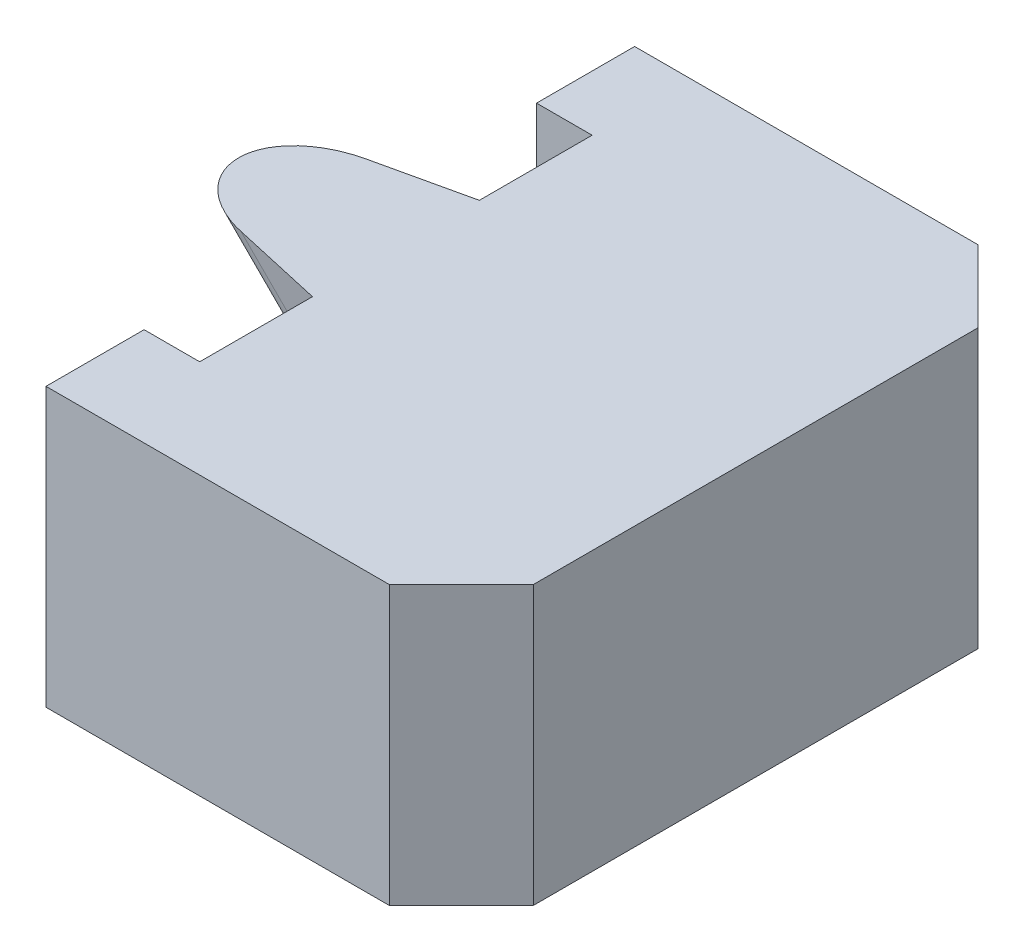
SolidWorks part; units mm, degrees
ref_plane "Vorne" through (0, 0, 0) normal (0, 0, 1) x (1, 0, 0)
ref_plane "Oben" through (0, 0, 0) normal (0, 1, 0) x (1, 0, 0)
ref_plane "Rechts" through (0, 0, 0) normal (1, 0, 0) x (0, 0, -1)
sketch "Skizze1" plane through (0, 0, 0) normal (0, 1, 0) x (1, 0, 0)
  line L1 (-44.6813, 23.83) -> (41.1068, 23.83)
  line L2 (-44.6813, 23.83) -> (-44.6813, -33.362)
  line L3 (-44.6813, -33.362) -> (41.1068, -33.362)
  line L4 (41.1068, 23.83) -> (41.1068, -33.362)
extrude "Linear austragen1" add sketch "Skizze1" along normal blind 12.5
sketch "Skizze2" plane through (0, 0, 0) normal (0, -1, 0) x (1, 0, 0)
  line L0 (-26.3604, 10.766) -> (-21.6604, 10.766)
  line L1 (-26.3604, 13.766) -> (-15.8604, 13.766)
  line L2 (-15.8604, 13.766) -> (-13.6604, 11.566)
  line L3 (-26.3604, -4.234) -> (-15.8604, -4.234)
  line L4 (-13.6604, 11.566) -> (-13.6604, -2.034)
  line L5 (-21.6604, 10.766) -> (-21.6604, -1.234)
  line L6 (-21.6604, -1.234) -> (-26.3604, -1.234)
  line L7 (-13.6604, -2.034) -> (-15.8604, -4.234)
  line L8 (-21.6604, 4.766) -> (-44.6813, 4.766) construction
  line L9 (-44.6813, -23.83) -> (-44.6813, 33.362) construction
  line L10 (-26.3604, -4.234) -> (-26.3604, -1.234)
  line L11 (-26.3604, 13.766) -> (-26.3604, 10.766)
  dimension "D1" = 18
  dimension "D2" = 3
  dimension "D3" = 3
  dimension "D6" = 8
extrude "Linear austragen2" add sketch "Skizze2" along normal blind 8.5
fillet "Verrundung1" radius 3 1 edges at (-21.6604, 0, 4.766)
ref_plane "Ebene1" through (0, 0, 4.766) normal (0, 0, -1) x (-1, 0, 0)
sketch "Skizze3" plane through (0, 0, 4.766) normal (0, 0, -1) x (-1, 0, 0)
  line L0 (19.6604, -6.5) -> (22.6604, -3.5)
  line L1 (26.3604, -8.5) -> (15.8604, -8.5) construction
  line L3 (15.8604, -8.5) -> (26.3604, -8.5) construction
  line L4 (13.6604, -8.5) -> (13.6604, 0) construction
  line L5 (26.3604, -8.5) -> (15.8604, -8.5) construction
  dimension "D1" = 45
  dimension "D2" = 2
  dimension "D3" = 9
  dimension "D4" = 5
ref_plane "Ebene2" through (-19.6604, -6.5, 4.766) normal (-0.7071, 0.7071, 0) x (0, 0, 1)
sketch "Skizze4" plane through (-19.6604, -6.5, 4.766) normal (-0.7071, 0.7071, 0) x (0, 0, 1)
  line L0 (0, -2.8284) -> (0, 4.5067) construction
  line L1 (-1.9154, -0.9378) -> (-3, 2.4716)
  line L2 (1.9154, -0.9378) -> (3, 2.4716)
  line L3 (-3, 2.4716) -> (3, 2.4716)
  line L5 (6, -2.8284) -> (-6, -2.8284) construction
  arc A0 (1.9154, -0.9378) -> (-1.9154, -0.9378) centre (0, -0.3284) cw
  point P8 (0, 2.4716)
  dimension "D4" = 2.01
  dimension "D1" = 6
  dimension "D2" = 5.3
  dimension "D3" = 2.5
extrude "Linear austragen3" add sketch "Skizze4" along normal blind 20
sketch "Skizze5" plane through (0, 0, -23.83) normal (0, 0, -1) x (-1, 0, 0)
  line L4 (-41.1068, 0) -> (44.6813, 0)
  line L5 (44.6813, 0) -> (44.6813, 12.5)
  line L6 (44.6813, 12.5) -> (-41.1068, 12.5)
  line L7 (-41.1068, 12.5) -> (-41.1068, 0)
  line L8 (-41.1068, 0) -> (44.6813, 0)
  line L9 (44.6813, 0) -> (44.6813, 12.5)
  line L10 (44.6813, 12.5) -> (-41.1068, 12.5)
  line L11 (-41.1068, 12.5) -> (-41.1068, 0)
  dimension "D1" = 0
extrude "Schnitt-Linear austragen1" cut sketch "Skizze5" against normal up to surface (57.1921 mm away)
sketch "Skizze6" plane through (0, 0, 0) normal (0, 1, 0) x (-1, 0, 0)
  line L12 (26.3604, -1.234) -> (24.6604, -1.234)
  line L13 (24.6604, -1.234) -> (24.6604, 2.2148)
  line L16 (24.6604, 2.2148) -> (27.4866, 2.8506)
  line L17 (24.6604, 10.766) -> (26.3604, 10.766)
  line L18 (24.6604, 2.2148) -> (27.4866, 2.8506)
  line L19 (26.3604, 13.766) -> (15.8604, 13.766)
  line L20 (13.6604, 11.566) -> (13.6604, -2.034)
  line L21 (15.8604, -4.234) -> (26.3604, -4.234)
  line L22 (26.3604, -4.234) -> (26.3604, -1.234)
  line L23 (26.3604, -1.234) -> (24.6604, -1.234)
  line L24 (24.6604, -1.234) -> (24.6604, 2.2148)
  line L25 (27.4866, 6.6814) -> (24.6604, 7.3172)
  line L26 (24.6604, 7.3172) -> (24.6604, 10.766)
  line L27 (24.6604, 7.3172) -> (24.6604, 10.766)
  line L28 (24.6604, 10.766) -> (26.3604, 10.766)
  line L29 (26.3604, -4.234) -> (26.3604, -1.234)
  line L30 (26.3604, 13.766) -> (15.8604, 13.766)
  line L31 (13.6604, 11.566) -> (13.6604, -2.034)
  line L32 (15.8604, -4.234) -> (26.3604, -4.234)
  line L33 (26.3604, 10.766) -> (26.3604, 13.766)
  line L34 (26.3604, 10.766) -> (26.3604, 13.766)
  line L35 (15.8604, 13.766) -> (13.6604, 11.566)
  line L36 (15.8604, 13.766) -> (13.6604, 11.566)
  line L37 (13.6604, -2.034) -> (15.8604, -4.234)
  line L38 (13.6604, -2.034) -> (15.8604, -4.234)
  line L39 (27.4866, 6.6814) -> (24.6604, 7.3172)
  ellipse E1 centre (26.6248, 4.766) end of major axis (23.7823, 4.766) minor radius 2.01 (27.4866, 2.8506) -> (27.4866, 6.6814) ccw
  ellipse E2 centre (26.6248, 4.766) end of major axis (23.7823, 4.766) minor radius 2.01 (27.4866, 2.8506) -> (27.4866, 6.6814) ccw
  dimension "D1" = 0
